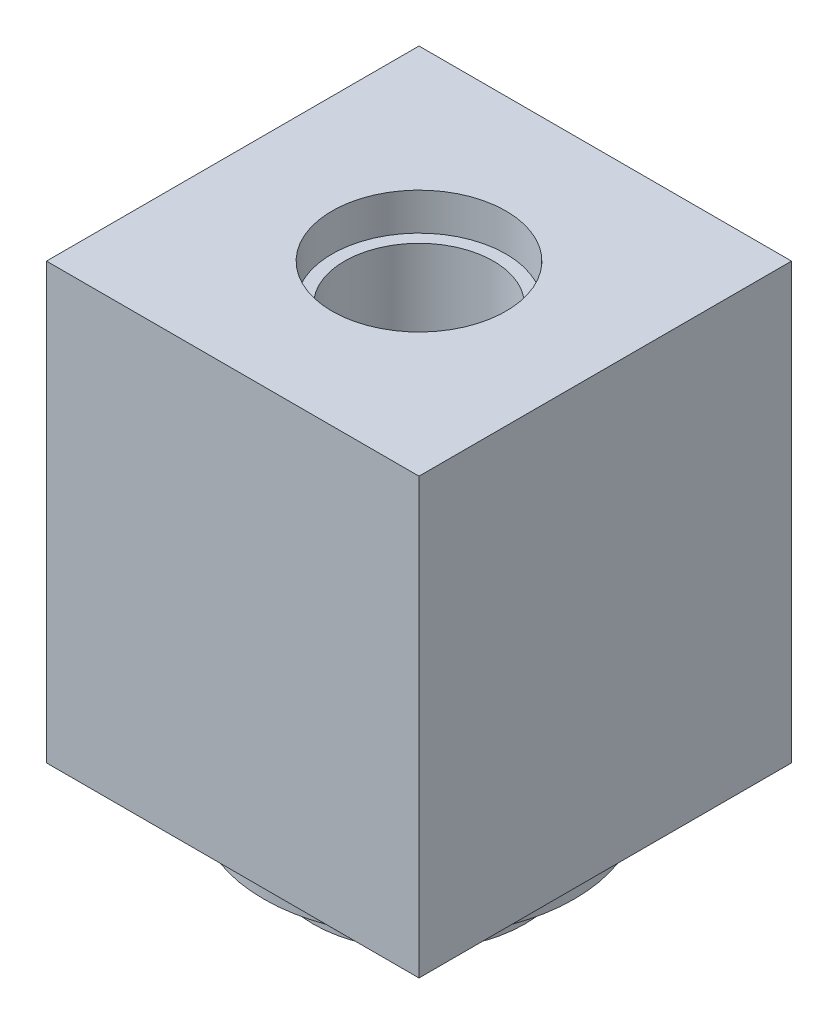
SolidWorks part; units mm, degrees
ref_plane "Přední rovina" through (0, 0, 0) normal (0, 0, 1) x (1, 0, 0)
ref_plane "Horní rovina" through (0, 0, 0) normal (0, 1, 0) x (1, 0, 0)
ref_plane "Pravá rovina" through (0, 0, 0) normal (1, 0, 0) x (0, 0, -1)
sketch "Skica1" plane through (0, 0, 0) normal (0, 1, 0) x (1, 0, 0)
  line L1 (-15, 15) -> (15, 15)
  line L2 (-15, 15) -> (-15, -15)
  line L3 (-15, -15) -> (15, -15)
  line L4 (15, 15) -> (15, -15)
  dimension "D1" = 30
  dimension "D2" = 30
  dimension "D3" = 15
  dimension "D4" = 15
extrude "Přidat vysunutím1" add sketch "Skica1" along normal blind 35
sketch "Skica2" plane through (0, 0, 0) normal (0, -1, 0) x (1, 0, 0)
  circle A0 centre (0, 0) radius 12.5
  dimension "D1" = 25
extrude "Přidat vysunutím2" add sketch "Skica2" along normal blind 7
sketch "Skica3" plane through (0, -7, 0) normal (0, -1, 0) x (1, 0, 0)
  circle A0 centre (0, 0) radius 8.5
  dimension "D1" = 17
extrude "Odebrat vysunutím1" cut sketch "Skica3" against normal blind 2 flip side to cut
chamfer "Zkosení1" distance 1.75 distance2 3 1 edges at (0, -5, -12.5)
hole_wizard "Ø15.0 (15) průměr díry1" positions "Skica5" profile "Skica4" hole size "Ø15.0" standard "DIN"
sketch "Skica5" plane through (0, -7, 0) normal (0, -1, 0) x (1, 0, 0)
  circle A0 centre (0, 0) radius 8.5 construction
  point P0 (0, 0)
  dimension "D1" = 0
sketch "Skica4" plane through (0, -7, 0) normal (1, 0, 0) x (0, 0, -1)
  line L0 (0, 0) -> (0, 11.3301)
  line L1 (0, 11.3301) -> (7.5, 7)
  line L2 (7.5, 7) -> (7.5, 0)
  line L5 (7.5, 0) -> (0, 0)
  line L10 (0, 11.3301) -> (-7.5, 7) construction
  line L11 (0, -6.35) -> (0, 107.95) construction
  dimension "Průměr díry" = 15
  dimension "Hloubka díry" = 7
  dimension "Úhel vrtání" = 120
sketch "Skica6" plane through (0, 35, 0) normal (0, 1, 0) x (1, 0, 0)
  circle A0 centre (0, 0) radius 6
extrude "Odebrat vysunutím2" cut sketch "Skica6" against normal through all
sketch "Skica11" plane through (0, 35, 0) normal (0, 1, 0) x (1, 0, 0)
  circle A0 centre (0, 0) radius 7
extrude "Odebrat vysunutím4" cut sketch "Skica11" against normal blind 3
hole_wizard "Ø6.0 (6) průměr díry1" positions "Skica13" profile "Skica12" hole size "Ø6.0" standard "DIN"
sketch "Skica13" plane through (-15, 0, 0) normal (-1, 0, 0) x (0, 0, 1)
  point P0 (0, 17.5)
  dimension "D1" = 17.5
  dimension "D2" = 0
sketch "Skica12" plane through (-15, 17.5, 0) normal (0, 1, 0) x (0, 0, 1)
  line L0 (0, 0) -> (0, 16.7321)
  line L1 (0, 16.7321) -> (3, 15)
  line L2 (3, 15) -> (3, 0)
  line L5 (3, 0) -> (0, 0)
  line L10 (0, 16.7321) -> (-3, 15) construction
  line L11 (0, -6.35) -> (0, 107.95) construction
  dimension "Průměr díry" = 6
  dimension "Hloubka díry" = 15
  dimension "Úhel vrtání" = 120
sketch "Skica14" plane through (-15, 0, 0) normal (-1, 0, 0) x (0, 0, 1)
  circle A0 centre (0, 17.5) radius 7
extrude "Odebrat vysunutím5" cut sketch "Skica14" against normal blind 2
chamfer "Zkosení2" distance 1 angle 45 1 edges at (-13, 17.5, 3)
